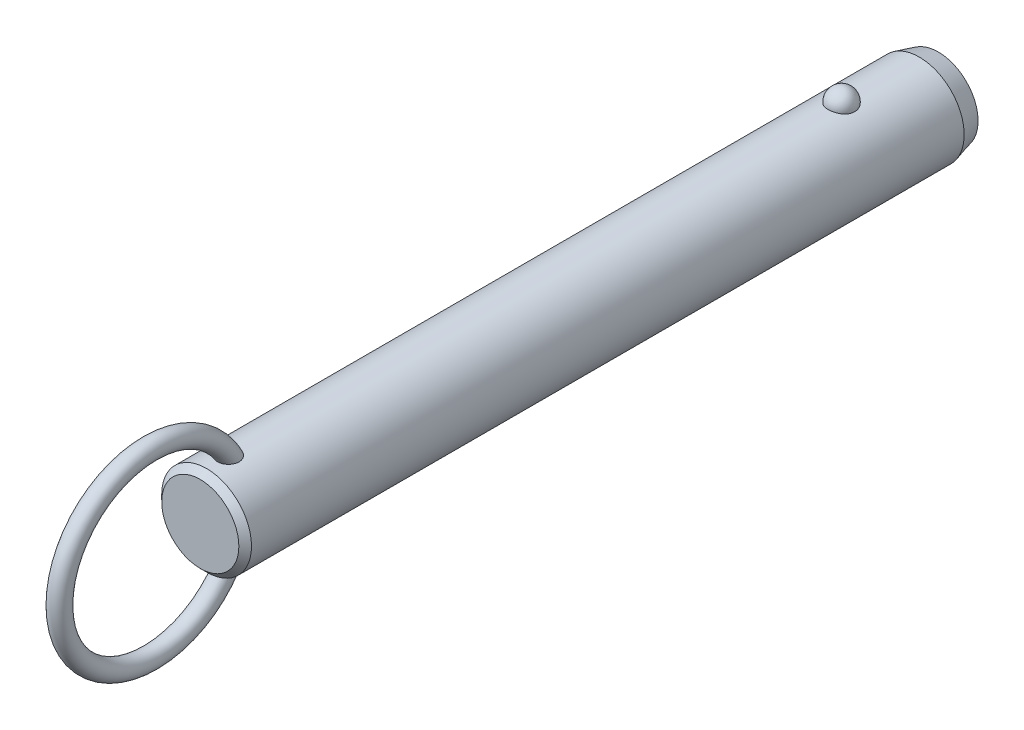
SolidWorks part; units mm, degrees
ref_plane "Front Plane" through (0, 0, 0) normal (0, 0, 1) x (1, 0, 0)
ref_plane "Top Plane" through (0, 0, 0) normal (0, 1, 0) x (1, 0, 0)
ref_plane "Right Plane" through (0, 0, 0) normal (1, 0, 0) x (0, 0, -1)
sketch "Sketch2" plane through (0, 0, 0) normal (0, 0, 1) x (1, 0, 0)
  circle A0 centre (0, 0) radius 7.1
  point P3 (0, 7.1)
  dimension "D1" = 14.2
extrude "Boss-Extrude1" add sketch "Sketch2" along normal blind 91.4
sketch "Sketch3" plane through (0, 0, 0) normal (0, 0, -1) x (-1, 0, 0)
  circle A0 centre (0, 0) radius 7.1
  dimension "D1" = 14.2
extrude "Boss-Extrude2" add sketch "Sketch3" along normal blind 17.4
chamfer "Chamfer1" distance 3 angle 15 1 edges at (-7.1, 0, -17.4)
sketch "Sketch12" plane through (0, 0, 0) normal (1, 0, 0) x (0, 0, -1)
  line L0 (-91.4, 7.1) -> (-91.4, -7.1) construction
  point P0 (-91.4, 0)
sketch "Sketch13" plane through (0, 0, 0) normal (1, 0, 0) x (0, 0, -1)
  circle A0 centre (-107.25, 0) radius 15.85
  point P2 (-91.4, 0)
  dimension "D1" = 31.7
sketch "Sketch14" plane through (0, 0, 0) normal (0, 1, 0) x (1, 0, 0)
  circle A0 centre (0, -92.9) radius 1.5
  point P2 (0, -91.4)
  dimension "D1" = 3
sweep "Sweep1" add profiles "Sketch14" path "Sketch13"
sketch "Sketch15" plane through (0, 0, 91.4) normal (0, 0, 1) x (1, 0, 0)
  circle A0 centre (0, 0) radius 7.1
  dimension "D1" = 14.2
extrude "Boss-Extrude3" add sketch "Sketch15" along normal blind 7.92
chamfer "Chamfer2" distance 1 angle 45 1 edges at (7.1, 0, 99.32)
sketch "Sketch18" plane through (0, 0, 0) normal (1, 0, 0) x (0, 0, -1)
  line L0 (14.4, 7.1) -> (-93.0792, 7.1) construction
  line L1 (2.1, 9.2) -> (2.1, 5)
  line L2 (-93.0792, -7.1) -> (14.4, -7.1) construction
  arc A0 (2.1, 9.2) -> (2.1, 5) centre (2.1, 7.1) ccw
  point P4 (0, 7.1)
  dimension "D1" = 16.3
revolve "Revolve1" add sketch "Sketch18" angle 360 about L1
